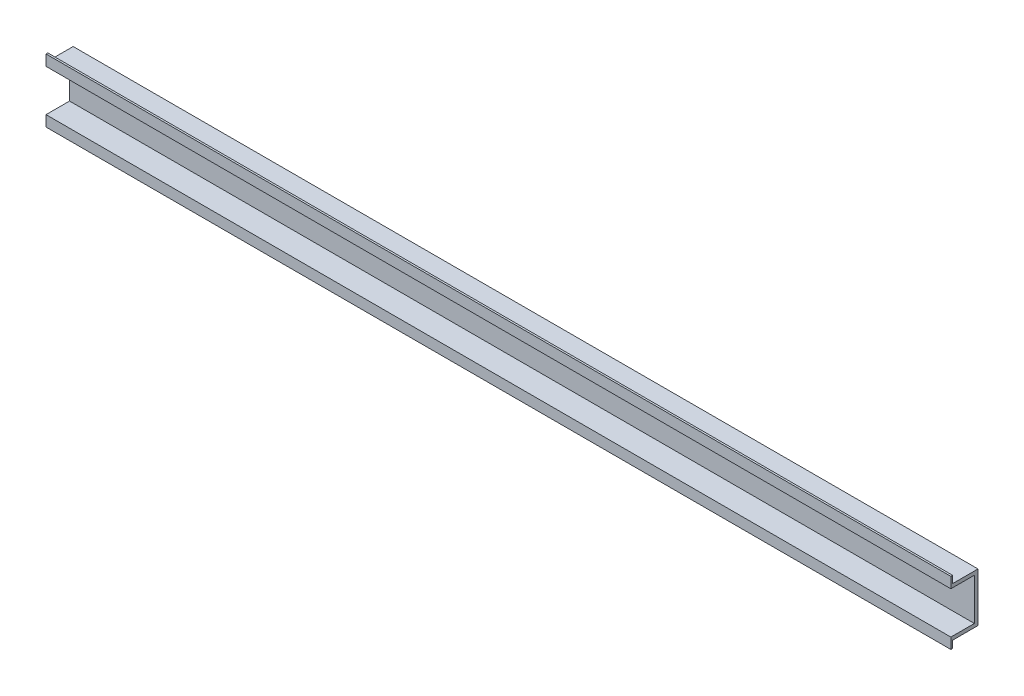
SolidWorks part; units mm, degrees
ref_plane "Plan de face" through (0, 0, 0) normal (0, 0, 1) x (1, 0, 0)
ref_plane "Plan de dessus" through (0, 0, 0) normal (0, 1, 0) x (1, 0, 0)
ref_plane "Plan de droite" through (0, 0, 0) normal (1, 0, 0) x (0, 0, -1)
sketch "EW_SKETCH" plane through (0, 0, 0) normal (1, 0, 0) x (0, 0, -1)
  line L0 (-15, -17.5) -> (-14, -17.5)
  line L1 (0, -13.55) -> (0, 13.55)
  line L2 (-14, 17.5) -> (-15, 17.5)
  line L3 (-15, 17.5) -> (-15, 11.55)
  line L4 (0, 13.55) -> (-14, 13.55)
  line L5 (-14, -13.55) -> (0, -13.55)
  line L6 (-14, 17.5) -> (-14, 13.55)
  line L7 (-15, -11.55) -> (-2, -11.55)
  line L8 (-2, 11.55) -> (-15, 11.55)
  line L9 (-2, -11.55) -> (-2, 11.55)
  line L10 (-15, -11.55) -> (-15, -17.5)
  line L11 (-14, -13.55) -> (-14, -17.5)
extrude "EW_EXTRUDE" add sketch "EW_SKETCH" along normal blind 500
equation "\"w1@EW_SKETCH\"=\"EW_WIDTH@EW_SKETCH\"*0.17"
equation "\"th1@EW_SKETCH\"=1"
equation "\"th2@EW_SKETCH\" = 2"
equation "\"th2_form@EW_SKETCH\"=\"th2@EW_SKETCH\""
equation "\"th2_form2@EW_SKETCH\"=\"th2@EW_SKETCH\""
